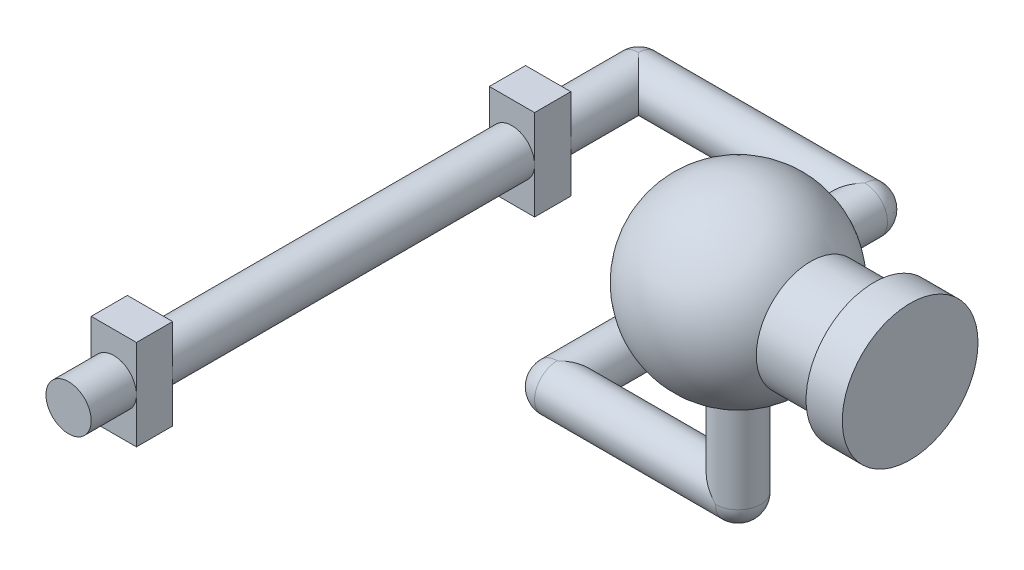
SolidWorks part; units mm, degrees
ref_plane "Face" through (0, 0, 0) normal (0, 0, 1) x (1, 0, 0)
ref_plane "Dessus" through (0, 0, 0) normal (0, 1, 0) x (1, 0, 0)
ref_plane "Droite" through (0, 0, 0) normal (1, 0, 0) x (0, 0, -1)
sketch "Esquisse1" plane through (0, 0, 0) normal (0, 0, 1) x (1, 0, 0)
  circle A0 centre (0, 0) radius 2.5
  dimension "D1" = 5
extrude "Base-Extrusion" add sketch "Esquisse1" along normal blind 5
sketch "Esquisse2" plane through (0, 0, 0) normal (0, 0, -1) x (-1, 0, 0)
  line L1 (-2.5, 5) -> (2.5, 5)
  line L2 (-2.5, 5) -> (-2.5, -5)
  line L3 (-2.5, -5) -> (2.5, -5)
  line L4 (2.5, 5) -> (2.5, -5)
  circle A0 centre (0, 0) radius 2.5 construction
  dimension "D1" = 5
  dimension "D2" = 5
extrude "Boss.-Extru.1" add sketch "Esquisse2" along normal blind 4
sketch "Esquisse3" plane through (0, 0, -4) normal (0, 0, -1) x (-1, 0, 0)
  arc A0 (2.5, 0) -> (-2.5, 0) centre (0, 0) ccw construction
  arc A1 (2.5, 0) -> (-2.5, 0) centre (0, 0) ccw
  arc A2 (-2.5, 0) -> (2.5, 0) centre (0, 0) ccw construction
  arc A3 (-2.5, 0) -> (2.5, 0) centre (0, 0) ccw
extrude "Boss.-Extru.2" add sketch "Esquisse3" along normal blind 40
sketch "Esquisse4" plane through (0, 0, -44) normal (0, 0, -1) x (-1, 0, 0)
  line L1 (-2.5, 5) -> (2.5, 5)
  line L2 (-2.5, 5) -> (-2.5, -5)
  line L3 (-2.5, -5) -> (2.5, -5)
  line L4 (2.5, 5) -> (2.5, -5)
extrude "Boss.-Extru.3" add sketch "Esquisse4" along normal blind 4
sketch "Esquisse5" plane through (0, 0, -48) normal (0, 0, -1) x (-1, 0, 0)
  arc A0 (2.5, 0) -> (-2.5, 0) centre (0, 0) ccw construction
  arc A1 (2.5, 0) -> (-2.5, 0) centre (0, 0) ccw
  arc A2 (-2.5, 0) -> (2.5, 0) centre (0, 0) ccw construction
  arc A3 (-2.5, 0) -> (2.5, 0) centre (0, 0) ccw
extrude "Boss.-Extru.4" add sketch "Esquisse5" along normal blind 10
sketch "Esquisse6" plane through (0, 0, 0) normal (1, 0, 0) x (0, 0, -1)
  line L0 (-5, 0) -> (0, 0) construction
  line L1 (58, -2.5) -> (58, 2.5) construction
  circle A0 centre (58, 0) radius 2.5
  dimension "D1" = 5
extrude "Boss.-Extru.5" add sketch "Esquisse6" along normal blind 25
sketch "Esquisse7" plane through (0, 0, -58) normal (0, 0, -1) x (-1, 0, 0)
  line L0 (-25, 0) -> (0, 0) construction
  line L1 (-25, 2.5) -> (-25, -2.5) construction
  circle A0 centre (-25, 0) radius 2.5
  dimension "D1" = 5
extrude "Boss.-Extru.6" add sketch "Esquisse7" against normal blind 34
sketch "Esquisse8" plane through (25, 0, 0) normal (1, 0, 0) x (0, 0, -1)
  line L0 (58, 0) -> (48, 0) construction
  line L1 (24, 2.5) -> (24, -2.5) construction
  circle A0 centre (24, 0) radius 2.5
  dimension "D1" = 5
extrude "Boss.-Extru.7" add sketch "Esquisse8" along normal blind 20
sketch "Esquisse9" plane through (0, 0, 0) normal (0, 1, 0) x (1, 0, 0)
  line L0 (45, 24) -> (25, 24) construction
  line L1 (45, 21.5) -> (45, 26.5) construction
  circle A0 centre (45, 24) radius 2.5
  dimension "D1" = 5
extrude "Boss.-Extru.8" add sketch "Esquisse9" along normal blind 20
sketch "Esquisse10" plane through (0, 20, 0) normal (0, 1, 0) x (-1, 0, 0)
  line L0 (-45, -34.2559) -> (-45, -11.0282) construction
  line L1 (-45, -26.5) -> (-45, -21.5) construction
  line L3 (-45, -34) -> (-45, -14)
  arc A1 (-45, -14) -> (-45, -34) centre (-45, -24) ccw
  circle A2 centre (-45, -24) radius 2.5 construction
  dimension "D1" = 10
revolve "Boss.-Révol.1" add sketch "Esquisse10" angle 360 about L0
sketch "Esquisse13" plane through (45, 0, 0) normal (1, 0, 0) x (0, 0, -1)
  line L0 (24, 10.3175) -> (24, 0) construction
  circle A0 centre (24, 20) radius 6
  arc A1 (26.5, 10.3175) -> (21.5, 10.3175) centre (24, 20) ccw construction
  dimension "D1" = 12
extrude "Boss.-Extru.11" add sketch "Esquisse13" along normal blind 15
sketch "Esquisse14" plane through (60, 0, 0) normal (1, 0, 0) x (0, 0, -1)
  circle A0 centre (24, 20) radius 7.5
  dimension "D1" = 15
extrude "Boss.-Extru.12" add sketch "Esquisse14" along normal blind 4
sketch "Esquisse15" plane through (0, 0, -58) normal (0, 0, -1) x (-1, 0, 0)
  line L0 (-25, 10.7583) -> (-25, -8.0213) construction
  line L1 (-25, -2.5) -> (-25, 2.5)
  line L2 (-25, -2.5) -> (-25, 2.5)
  arc A1 (-25, 2.5) -> (-25, -2.5) centre (-25, 0) ccw
  arc A2 (-25, 2.5) -> (-25, -2.5) centre (-25, 0) ccw
  dimension "D1" = 0
revolve "Boss.-Révol.2" add sketch "Esquisse15" angle 360 about L0
sketch "Esquisse16" plane through (0, 0, -24) normal (0, 0, 1) x (1, 0, 0)
  line L0 (25, -7.0542) -> (25, 11.906) construction
  line L1 (25, -2.5) -> (25, 2.5)
  line L2 (25, -2.5) -> (25, 2.5)
  arc A1 (25, 2.5) -> (25, -2.5) centre (25, 0) ccw
  arc A2 (25, 2.5) -> (25, -2.5) centre (25, 0) ccw
  dimension "D1" = 0
revolve "Boss.-Révol.3" add sketch "Esquisse16" angle 360 about L0
sketch "Esquisse17" plane through (45, 0, 0) normal (1, 0, 0) x (0, 0, -1)
  line L0 (11.6883, 0) -> (38.8884, 0) construction
  line L1 (26.5, 0) -> (21.5, 0)
  line L2 (26.5, 0) -> (21.5, 0)
  arc A1 (21.5, 0) -> (26.5, 0) centre (24, 0) ccw
  arc A2 (21.5, 0) -> (26.5, 0) centre (24, 0) ccw
  dimension "D1" = 0
revolve "Boss.-Révol.4" add sketch "Esquisse17" angle 360 about L0
sketch "Esquisse18" plane through (0, 0, -58) normal (0, 0, -1) x (-1, 0, 0)
  line L0 (0, 12.2704) -> (0, -13.5783) construction
  line L1 (0, 2.5) -> (0, -2.5)
  line L2 (0, 2.5) -> (0, -2.5)
  arc A1 (0, -2.5) -> (0, 2.5) centre (0, 0) ccw
  arc A2 (0, -2.5) -> (0, 2.5) centre (0, 0) ccw
  dimension "D1" = 0
revolve "Boss.-Révol.5" add sketch "Esquisse18" angle 360 about L0
ref_plane "Plan1" through (0, 0, -24) normal (0, 0, 1) x (1, 0, 0)
sketch "Esquisse19" plane through (0, 0, -24) normal (0, 0, 1) x (1, 0, 0)
  text T0 "M" font "Arial" height in points 36
extrude "Enlèv. mat.-Extru.1" cut sketch "Esquisse19" against normal blind 10
